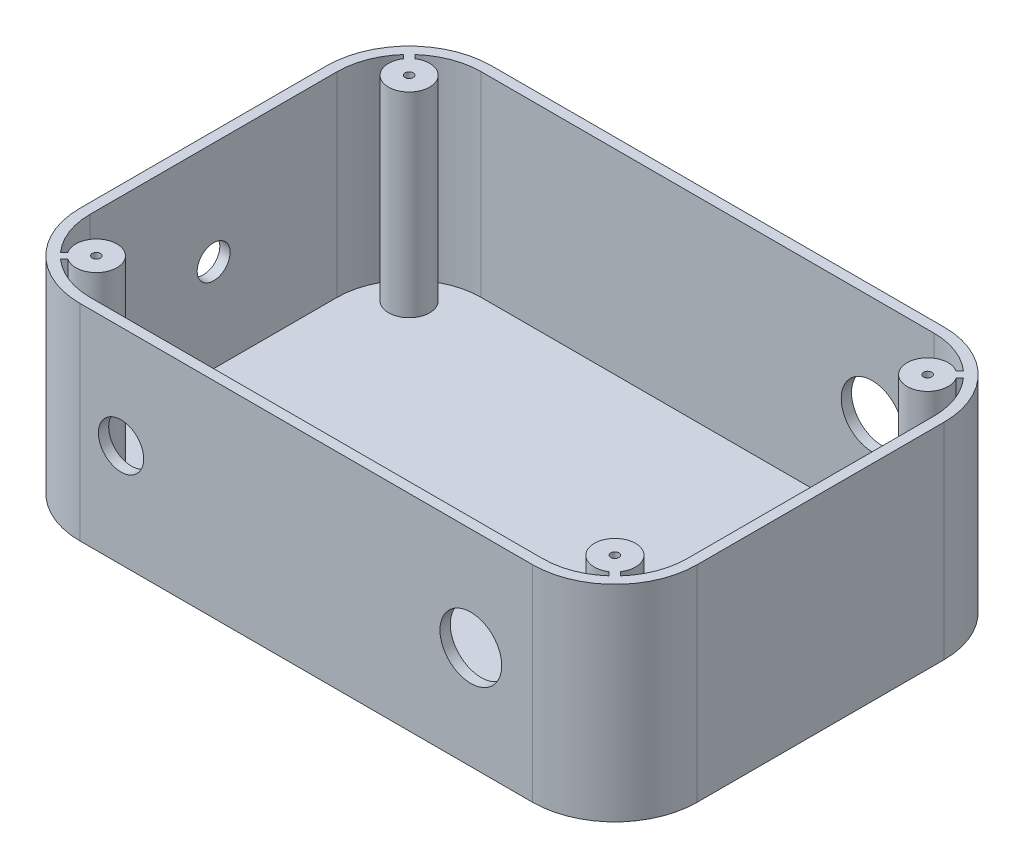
SolidWorks part; units mm, degrees
ref_plane "Front Plane" through (0, 0, 0) normal (0, 0, 1) x (1, 0, 0)
ref_plane "Top Plane" through (0, 0, 0) normal (0, 1, 0) x (1, 0, 0)
ref_plane "Right Plane" through (0, 0, 0) normal (1, 0, 0) x (0, 0, -1)
sketch "Sketch1" plane through (0, 0, 0) normal (0, 1, 0) x (1, 0, 0)
  line L1 (-75, -50) -> (75, -50)
  line L2 (-75, -50) -> (-75, 50)
  line L3 (-75, 50) -> (75, 50)
  line L4 (75, -50) -> (75, 50)
  line L5 (-75, -50) -> (75, 50) construction
  line L6 (-75, 50) -> (75, -50) construction
  point P0 (0, 0)
  dimension "D1" = 150
  dimension "D2" = 100
extrude "Boss-Extrude1" add sketch "Sketch1" along normal blind 50
fillet "Fillet1" radius 20 4 edges at (75, 25, 50) (-75, 25, 50) (-75, 25, -50) (75, 25, -50)
shell "Shell1" thickness 2.5
sketch "Sketch2" plane through (0, 0, 0) normal (0, -1, 0) x (1, 0, 0)
  line L0 (-55, 50) -> (55, 50) construction
  line L1 (-75, -30) -> (-75, 30) construction
  line L2 (-69.1421, 44.1421) -> (-63, 38) construction
  line L7 (-67.1712, 40.757) -> (-69.8316, 43.4173)
  line L8 (-65.757, 42.1712) -> (-68.4173, 44.8316)
  arc A0 (-67.1712, 40.757) -> (-65.757, 42.1712) centre (-63, 38) ccw
  arc A1 (-68.4173, 44.8316) -> (-69.8316, 43.4173) centre (-55, 30) ccw
  arc A5 (-55, 50) -> (-75, 30) centre (-55, 30) ccw construction
  point P5 (-68.4271, 44.8227)
  point P8 (-65.7202, 42.1953)
  point P12 (-63.1442, 38.1442)
  dimension "D2" = 12
  dimension "D3" = 10
  dimension "D1" = 12
  dimension "D4" = 2
  dimension "D5" = 1
extrude "Boss-Extrude2" add sketch "Sketch2" against normal blind 50 from offset 0
sketch "Sketch6" plane through (0, 50, 0) normal (0, 1, 0) x (1, 0, 0)
  circle A0 centre (-63, -38) radius 1
  dimension "D1" = 2
extrude "Cut-Extrude3" cut sketch "Sketch6" against normal blind 46
mirror "Mirror1" about plane through (0, 0, 0) normal (0, 0, 1) of "Boss-Extrude2", "Cut-Extrude3"
mirror "Mirror2" about plane through (0, 0, 0) normal (1, 0, 0) of "Mirror1", "Boss-Extrude2", "Cut-Extrude3"
sketch "Sketch7" plane through (0, 0, -50) normal (0, 0, -1) x (-1, 0, 0)
  line L0 (-55, 25) -> (55, 25) construction
  line L1 (-55, 50) -> (-55, 0) construction
  line L2 (55, 0) -> (55, 50) construction
  line L3 (-75, 0) -> (-75, 50) construction
  circle A0 centre (-40, 25) radius 7.5
  dimension "D1" = 15
  dimension "D2" = 35
extrude "Cut-Extrude4" cut sketch "Sketch7" against normal through all
sketch "Sketch8" plane through (0, 0, 50) normal (0, 0, 1) x (1, 0, 0)
  line L0 (-55, 25) -> (55, 25) construction
  line L1 (-55, 50) -> (-55, 0) construction
  line L2 (55, 0) -> (55, 50) construction
  line L3 (-75, 0) -> (-75, 50) construction
  circle A0 centre (-45, 25) radius 5.5
  dimension "D1" = 11
  dimension "D2" = 30
extrude "Cut-Extrude5" cut sketch "Sketch8" against normal blind 46
sketch "Sketch9" plane through (-75, 0, 0) normal (-1, 0, 0) x (0, 0, 1)
  line L0 (-30, 25) -> (30, 25) construction
  line L1 (-30, 50) -> (-30, 0) construction
  line L2 (30, 0) -> (30, 50) construction
  circle A0 centre (0, 25) radius 4
  dimension "D1" = 8
extrude "Cut-Extrude6" cut sketch "Sketch9" against normal blind 46
